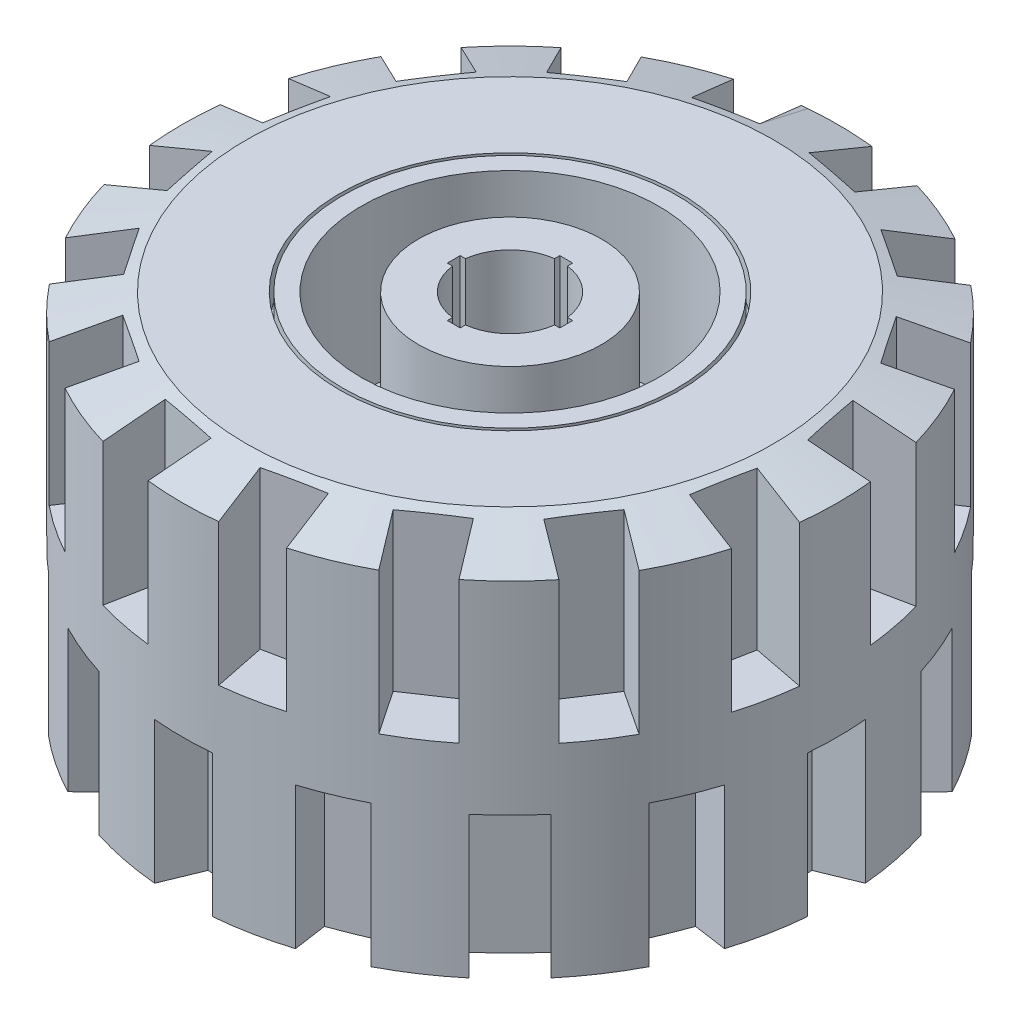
SolidWorks part; units mm, degrees
ref_plane "Plano frontal" through (0, 0, 0) normal (0, 0, 1) x (1, 0, 0)
ref_plane "Plano superior" through (0, 0, 0) normal (0, 1, 0) x (1, 0, 0)
ref_plane "Plano direito" through (0, 0, 0) normal (1, 0, 0) x (0, 0, -1)
sketch "Esboço1" plane through (0, 0, 0) normal (0, 0, 1) x (1, 0, 0)
  line L0 (0, 0) -> (0, 15.1855) construction
  line L1 (0, 0) -> (10.2, 0)
  line L2 (10.2, 0) -> (10.2, 11.9)
  line L3 (10.2, 11.9) -> (0, 11.9)
  line L4 (0, 11.9) -> (0, 0)
  dimension "D1" = 10.2
  dimension "D2" = 11.9
revolve "Revolução1" add sketch "Esboço1" angle 360 about L0
sketch "Esboço3" plane through (0, 0, 0) normal (0, 0, 1) x (1, 0, 0)
  line L0 (-8.2, 11.9) -> (-10.2, 11.3131)
  line L1 (10.2, 11.9) -> (-10.2, 11.9) construction
  line L2 (-10.2, 11.9) -> (-10.2, 0) construction
  line L3 (-10.2, 11.3131) -> (-10.2, 11.9)
  line L4 (-10.2, 11.9) -> (-8.2, 11.9)
  line L5 (-10.2, 5.95) -> (-8.2, 5.95) construction
  line L6 (-10.2, 0.5869) -> (-10.2, 0)
  line L7 (-10.2, 0) -> (-8.2, 0)
  line L8 (-8.2, 0) -> (-10.2, 0.5869)
  line L9 (0, 13.1549) -> (0, 0) construction
  dimension "D1" = 2
  dimension "D2" = 2.0843
revolve "Corte-Revolução1" cut sketch "Esboço3" angle 360 about L9
sketch "Esboço4" plane through (0, 0, 0) normal (0, -1, 0) x (1, 0, 0)
  line L0 (0, 9.8016) -> (0, 7.1984) construction
  line L1 (0, 10.2) -> (-0.9, 10.2)
  line L2 (-0.9, 10.2) -> (-0.9, 8.5)
  line L3 (-0.9, 8.5) -> (0.9, 8.5)
  line L4 (0.9, 8.5) -> (0.9, 10.2)
  line L5 (0.9, 10.2) -> (0, 10.2)
  circle A0 centre (0, 0) radius 10.2 construction
  point P6 (0, 8.5)
  dimension "D1" = 1.8
  dimension "D2" = 1.7
extrude "Corte-extrusão1" cut sketch "Esboço4" against normal blind 5
pattern_circular "PadrãoCircular1" count 16 over 360 about axis through (0, 0, 0) along (0, 1, 0) of "Corte-extrusão1"
sketch "Esboço5" plane through (0, 11.9, 0) normal (0, 1, 0) x (1, 0, 0)
  line L0 (0, 0) -> (3.3793, 16.6614) construction
  line L1 (1.1297, 10.1709) -> (2.8968, 9.8283)
  line L2 (2.8968, 9.8283) -> (2.5732, 8.1594)
  line L3 (2.5732, 8.1594) -> (0.8061, 8.502)
  line L4 (0.8061, 8.502) -> (1.1297, 10.1709)
  circle A0 centre (0, 0) radius 10.2 construction
  point P5 (1.6897, 8.3307)
  dimension "D1" = 1.8
  dimension "D2" = 1.7
extrude "Corte-extrusão2" cut sketch "Esboço5" against normal blind 5
pattern_circular "PadrãoCircular2" count 16 over 360 about axis through (0, 0, 0) along (0, 1, 0) of "Corte-extrusão2"
sketch "Esboço6" plane through (0, 0, 0) normal (0, -1, 0) x (1, 0, 0)
  circle A0 centre (0, 0) radius 5.5
  circle A1 centre (0, 0) radius 5.4
  dimension "D1" = 11
  dimension "D2" = 0.1
extrude "Corte-extrusão3" cut sketch "Esboço6" against normal blind 1
sketch "Esboço8" plane through (0, 0, 0) normal (0, -1, 0) x (1, 0, 0)
  circle A0 centre (0, 0) radius 5.17
  dimension "D1" = 10.34
extrude "Corte-extrusão4" cut sketch "Esboço8" against normal blind 3.6
sketch "Esboço9" plane through (0, 3.6, 0) normal (0, -1, 0) x (1, 0, 0)
  line L0 (0.3, -0.3) -> (4.9722, -0.3)
  line L1 (0.3, 0.3) -> (4.9722, 0.3)
  line L2 (-0.3, 4.9722) -> (-0.3, 0.3)
  line L3 (-4.9722, -0.3) -> (-0.3, -0.3)
  line L4 (0.3, 4.9722) -> (0.3, 0.3)
  line L5 (-4.9722, 0.3) -> (-0.3, 0.3)
  line L6 (-0.3, -0.3) -> (-0.3, -4.9722)
  line L7 (0.3, -0.3) -> (0.3, -4.9722)
  circle A0 centre (0, 0) radius 4.9812
extrude "Corte-extrusão5" cut sketch "Esboço9" against normal blind 2 contours L2 A0 L5 | L3 A0 L6 | L7 A0 L0 | L1 A0 L4
sketch "Esboço10" plane through (0, 5.6, 0) normal (0, -1, 0) x (1, 0, 0)
  circle A0 centre (0, 0) radius 2.3
  dimension "D1" = 4.6
extrude "Ressalto-extrusão1" add sketch "Esboço10" along normal blind 2
sketch "Esboço11" plane through (0, 11.9, 0) normal (0, 1, 0) x (1, 0, 0)
  circle A0 centre (0, 0) radius 5.3
  circle A1 centre (0, 0) radius 5.2
  dimension "D1" = 10.6
  dimension "D2" = 0.1
extrude "Corte-extrusão6" cut sketch "Esboço11" against normal blind 1
sketch "Esboço12" plane through (0, 11.9, 0) normal (0, 1, 0) x (1, 0, 0)
  line L2 (-0.2, 1.75) -> (-0.2, 1.5875)
  line L3 (-1.75, -0.2) -> (-1.5875, -0.2)
  line L4 (0.2, 1.75) -> (0.2, 1.5875)
  line L5 (-1.75, 0.2) -> (-1.5875, 0.2)
  line L6 (-1.75, 0.2) -> (-1.75, -0.2)
  line L7 (1.75, 0.2) -> (1.75, -0.2)
  line L8 (-0.2, 1.75) -> (0.2, 1.75)
  line L9 (-0.2, -1.75) -> (0.2, -1.75)
  line L18 (-0.2, -1.5875) -> (-0.2, -1.75)
  line L20 (0.2, -1.5875) -> (0.2, -1.75)
  line L21 (1.5875, -0.2) -> (1.75, -0.2)
  line L23 (1.5875, 0.2) -> (1.75, 0.2)
  circle A0 centre (0, 0) radius 4.625
  circle A1 centre (0, 0) radius 2.85
  arc A2 (-0.2, 1.5875) -> (-1.5875, 0.2) centre (0, 0) ccw
  arc A3 (1.5875, 0.2) -> (0.2, 1.5875) centre (0, 0) ccw
  arc A4 (-1.5875, -0.2) -> (-0.2, -1.5875) centre (0, 0) ccw
  arc A5 (0.2, -1.5875) -> (1.5875, -0.2) centre (0, 0) ccw
  dimension "D1" = 9.25
  dimension "D2" = 5.7
  dimension "D3" = 3.2
extrude "Corte-extrusão7" cut sketch "Esboço12" against normal blind 5 contours A0 A1 | L20 A5 L21 L7 L23 A3 L4 L8 L2 A2 L5 L6 L3 A4 L18 L9
